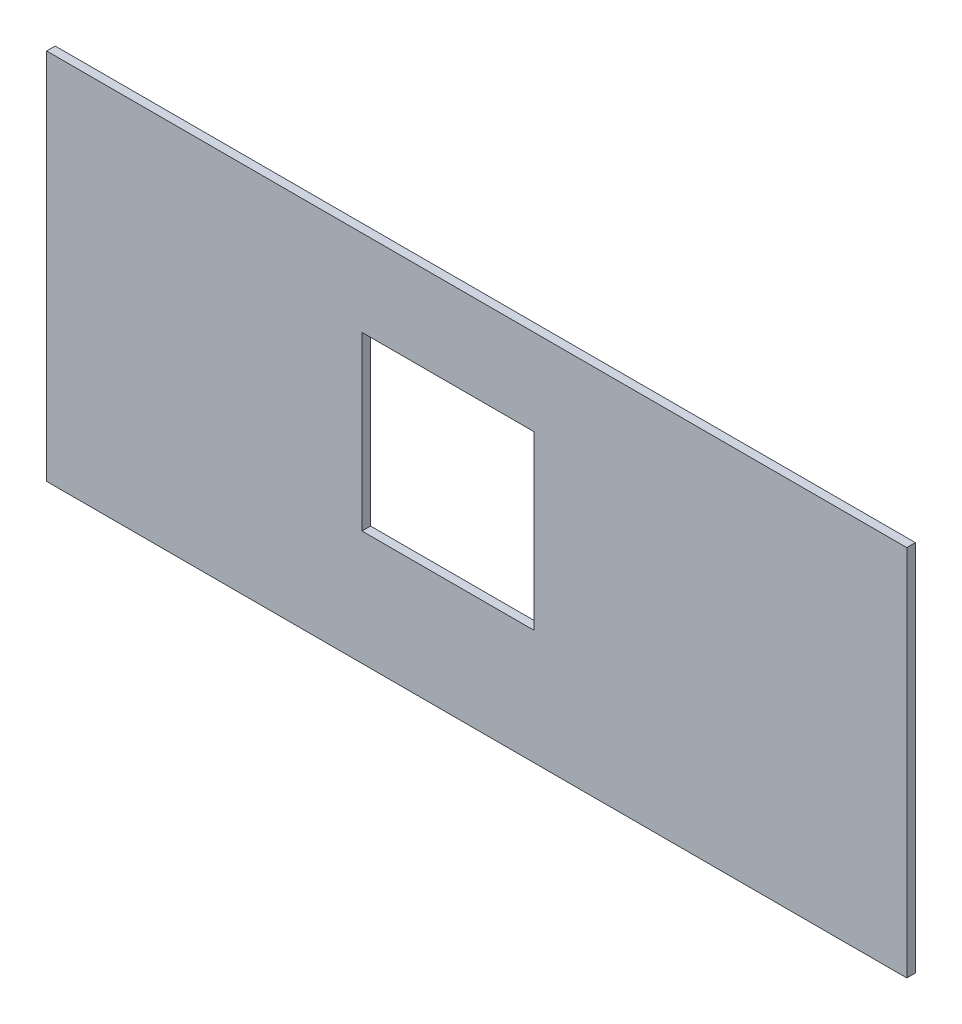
SolidWorks part; units mm, degrees
ref_plane "Plan de face" through (0, 0, 0) normal (0, 0, 1) x (1, 0, 0)
ref_plane "Plan de dessus" through (0, 0, 0) normal (0, 1, 0) x (1, 0, 0)
ref_plane "Plan de droite" through (0, 0, 0) normal (1, 0, 0) x (0, 0, -1)
sketch "Esquisse1" plane through (0, 0, 0) normal (0, 0, 1) x (1, 0, 0)
  line L1 (0, 0) -> (300, 0)
  line L2 (0, 0) -> (0, 130)
  line L3 (0, 130) -> (300, 130)
  line L4 (300, 0) -> (300, 130)
  line L5 (110, 100) -> (170, 100)
  line L6 (110, 100) -> (110, 40)
  line L7 (110, 40) -> (170, 40)
  line L8 (170, 100) -> (170, 40)
  dimension "D1" = 300
  dimension "D2" = 130
extrude "Extrusion1" add sketch "Esquisse1" along normal blind 3
